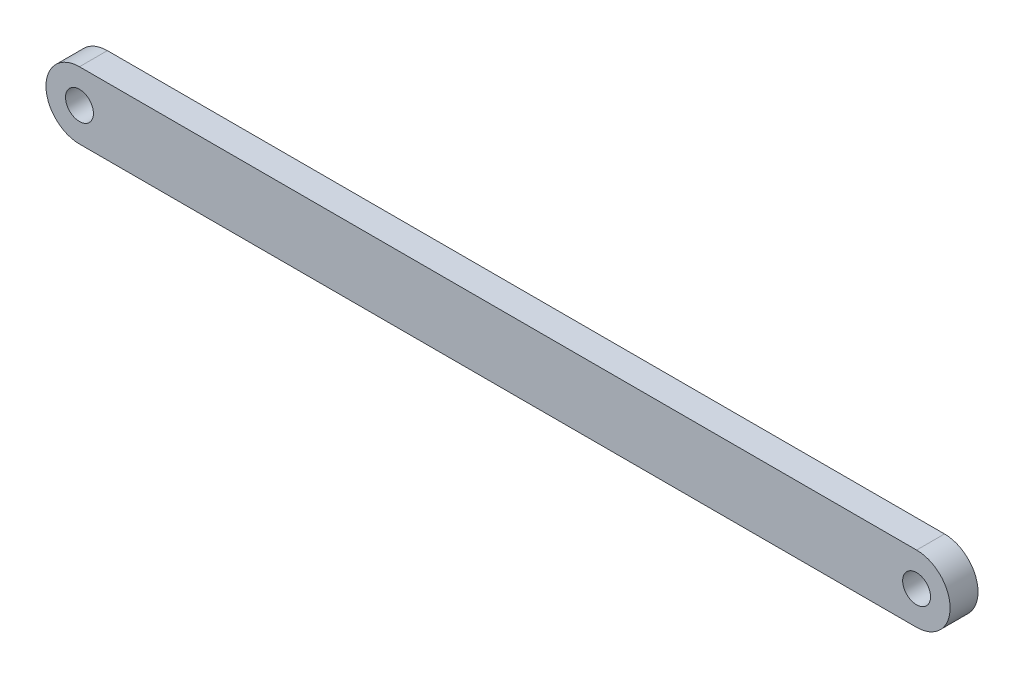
SolidWorks part; units mm, degrees
ref_plane "Alzado" through (0, 0, 0) normal (0, 0, 1) x (1, 0, 0)
ref_plane "Planta" through (0, 0, 0) normal (0, 1, 0) x (1, 0, 0)
ref_plane "Vista lateral" through (0, 0, 0) normal (1, 0, 0) x (0, 0, -1)
sketch "Croquis1" plane through (0, 0, 0) normal (0, 0, 1) x (1, 0, 0)
  line L0 (-75, 0) -> (75, 0) construction
  line L1 (-75, 6) -> (75, 6)
  line L2 (-75, -6) -> (75, -6)
  arc A0 (-75, 6) -> (-75, -6) centre (-75, 0) ccw
  arc A1 (75, -6) -> (75, 6) centre (75, 0) ccw
  circle A2 centre (75, 0) radius 2.5
  circle A3 centre (-75, 0) radius 2.5
  point P3 (0, 0)
  dimension "D2" = 6
  dimension "D3" = 5
  dimension "D4" = 5
  dimension "D1" = 150
extrude "Saliente-Extruir1" add sketch "Croquis1" along normal mid plane 5
